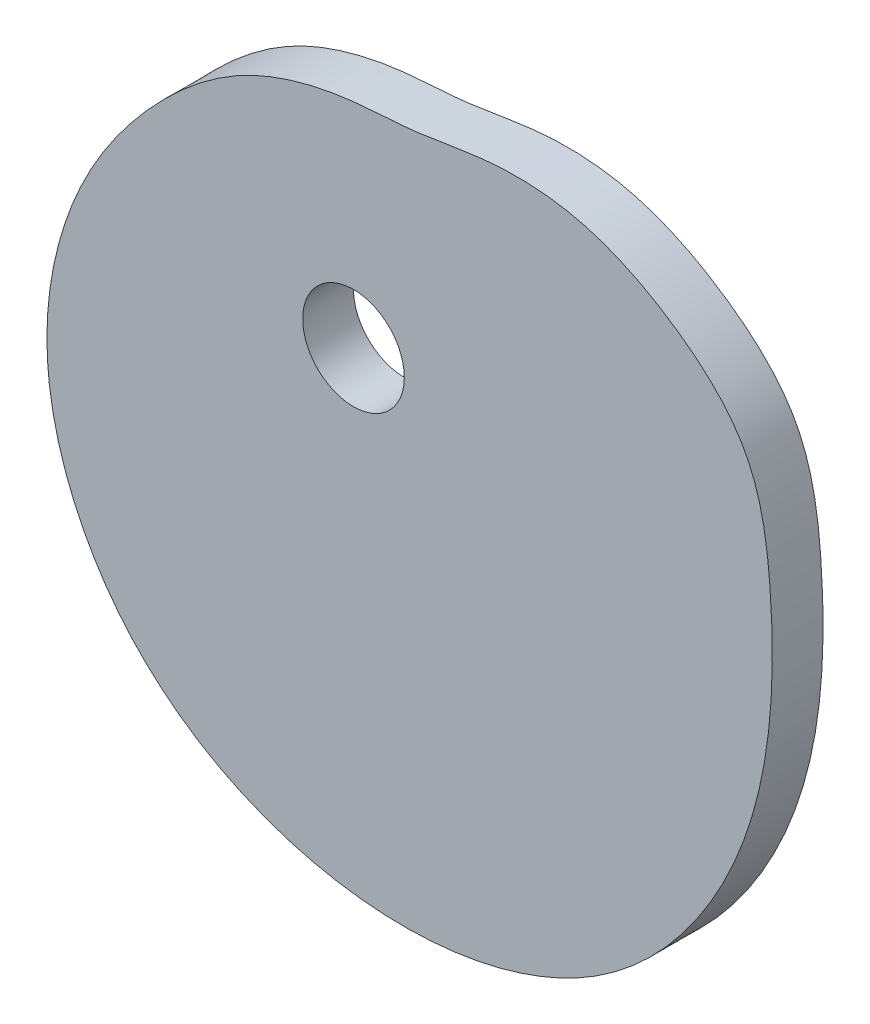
SolidWorks part; units mm, degrees
ref_plane "Front" through (0, 0, 0) normal (0, 0, 1) x (1, 0, 0)
ref_plane "Top" through (0, 0, 0) normal (0, 1, 0) x (1, 0, 0)
ref_plane "Right" through (0, 0, 0) normal (1, 0, 0) x (0, 0, -1)
sketch "Sketch1" plane through (0, 0, 0) normal (0, 0, 1) x (1, 0, 0)
  circle A0 centre (0, 0) radius 10
  point P0 (0, 42)
  point P4 (-21, 36)
  point P5 (-39, 22)
  point P6 (-54, 0)
  point P7 (-60, -35)
  point P8 (-42, -73)
  point P9 (0, -93)
  point P10 (48, -83)
  point P11 (77, -45)
  point P12 (82, 0)
  point P13 (77, 21)
  point P14 (62, 36)
  point P15 (44, 44)
  point P16 (26, 45)
  point P17 (12, 43)
  point P18 (0, 42)
  point P19 (-21, 36)
  point P21 (-39, 22)
  point P23 (-54, 0)
  point P25 (-60, -35)
  point P27 (-42, -73)
  point P29 (0, -93)
  point P31 (48, -83)
  point P33 (77, -45)
  point P35 (82, 0)
  point P37 (77, 21)
  point P39 (62, 36)
  point P41 (44, 44)
  point P43 (26, 45)
  point P45 (12, 43)
extrude "Extrude1" add sketch "Sketch1" along normal blind 10
